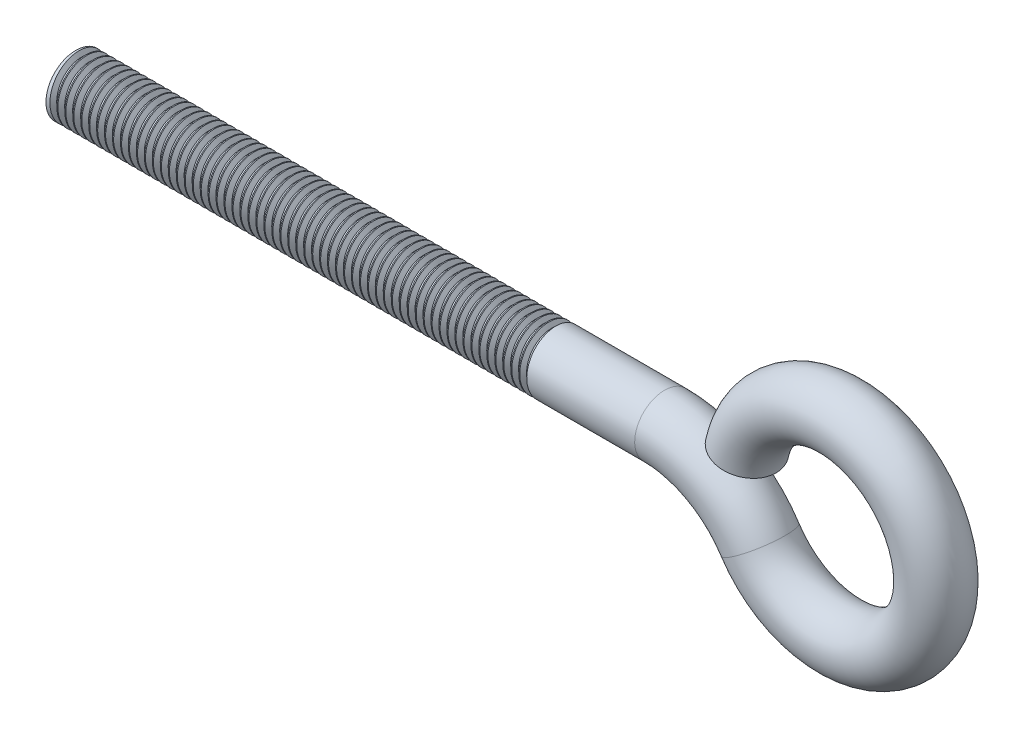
SolidWorks part; units mm, degrees
ref_plane "Front Plane" through (0, 0, 0) normal (0, 0, 1) x (1, 0, 0)
ref_plane "Top Plane" through (0, 0, 0) normal (0, 1, 0) x (1, 0, 0)
ref_plane "Right Plane" through (0, 0, 0) normal (1, 0, 0) x (0, 0, -1)
sketch "Sketch1" plane through (0, 0, 0) normal (0, 0, 1) x (1, 0, 0)
  line L0 (0, 0) -> (78.2411, 0)
  arc A0 (90.9411, -6.9049) -> (89.1937, 2.7152) centre (101.6, 0) ccw
  arc A1 (78.2411, 0) -> (90.9411, -6.9049) centre (78.2411, -15.1319) cw
  point P4 (0, 0)
  point P8 (0, 0)
  point P9 (0, 0)
  point P10 (0, 0)
  dimension "D1" = 12.7
  dimension "D2" = 101.6
  dimension "D3" = 12.7
sketch "Sketch2" plane through (0, 0, 0) normal (1, 0, 0) x (0, 0, -1)
  circle A0 centre (0, 0) radius 3.9688
  dimension "D1" = 7.9375
sweep "Sweep1" add profiles "Sketch2" path "Sketch1"
thread "Thread1" pitch 1.0583 start angle 0, offset 0, length 63.5, pitch 1.0583, diameter 7.9375
ref_plane "Plane1" through (0, 0, -3.9688) normal (0, -1, 0) x (0, 0, -1)
sketch "Thread Profile1" plane through (0, 0, -3.9688) normal (0, -1, 0) x (0, 0, -1)
  line L0 (0, 0) -> (0, 1.0583) construction
  line L11 (0, 0) -> (0, 0.926)
  line L12 (0, 0.926) -> (-0.5728, 0.5953)
  line L13 (-0.5728, 0.5953) -> (-0.5728, 0.3307)
  line L15 (-0.5728, 0.3307) -> (0, 0)
  line L17 (-0.5728, 0.463) -> (0, 0.463) construction
  point P2 (0, 0)
  dimension "Pitch" = 1.0583
  dimension "Profile_Angle" = 60
  dimension "Profile_Land" = 0.2646
  dimension "Profile_Height" = 0.5728
